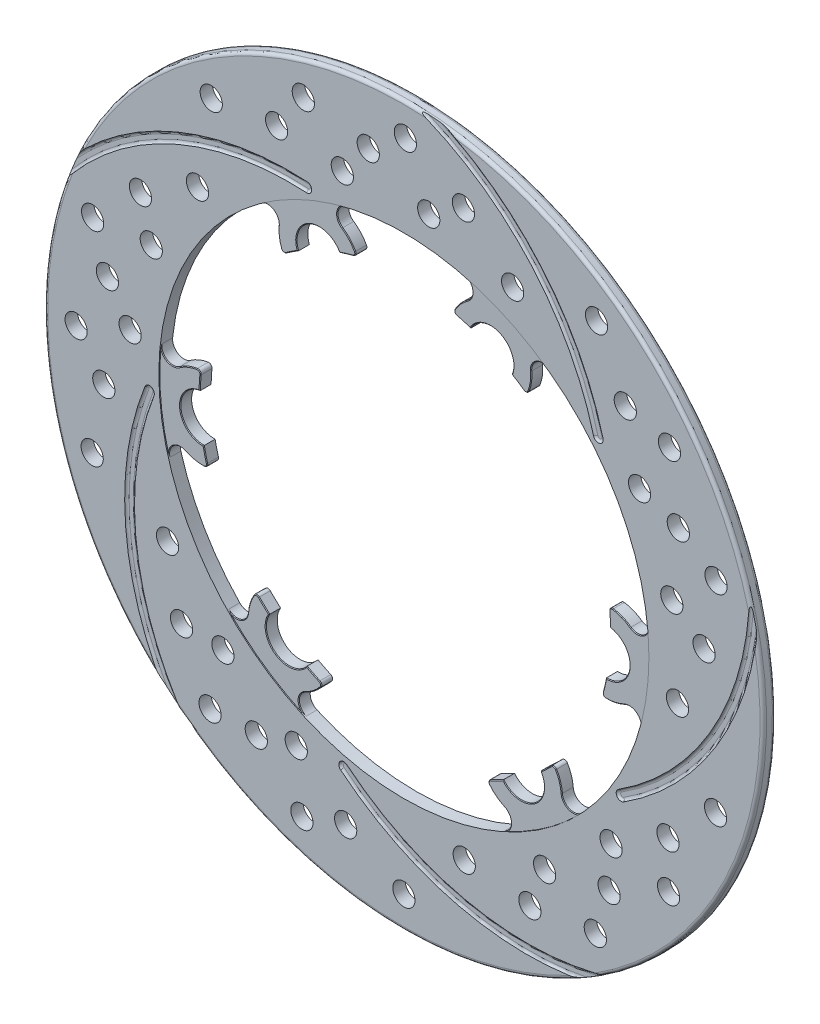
SolidWorks part; units mm, degrees
ref_plane "正面" through (0, 0, 0) normal (0, 0, 1) x (1, 0, 0)
ref_plane "平面" through (0, 0, 0) normal (0, 1, 0) x (1, 0, 0)
ref_plane "右側面" through (0, 0, 0) normal (1, 0, 0) x (0, 0, -1)
sketch "ｽｹｯﾁ1" plane through (0, 0, 0) normal (0, 0, 1) x (1, 0, 0)
  circle A0 centre (0, 0) radius 110
  dimension "D1" = 220
extrude "ﾎﾞｽ - 押し出し1" add sketch "ｽｹｯﾁ1" along normal blind 3.8
sketch "ｽｹｯﾁ2" plane through (0, 0, 0) normal (0, 0, -1) x (-1, 0, 0)
  circle A0 centre (0, 0) radius 75
  dimension "D1" = 150
extrude "ｶｯﾄ - 押し出し1" cut sketch "ｽｹｯﾁ2" against normal blind 4
sketch "ｽｹｯﾁ3" plane through (0, 0, 0) normal (0, 0, -1) x (-1, 0, 0)
  line L0 (0, 0) -> (0, 75) construction
  line L1 (0, 0) -> (26.2023, 56.1911) construction
  arc A7 (18.0218, 72.8026) -> (44.1858, 60.6021) centre (0, 0) cw
  circle A8 centre (0, 0) radius 75 construction
  arc A9 (20.0423, 59.5159) -> (32.7089, 53.6094) centre (26.2023, 56.1911) cw
  arc A10 (15.2472, 62.2106) -> (19.1542, 66.5146) centre (26.2023, 56.1911) cw
  arc A11 (36.3444, 51.2145) -> (32.7089, 53.6094) centre (0, 0) ccw
  arc A12 (20.0423, 59.5159) -> (15.8709, 60.7615) centre (0, 0) ccw
  arc A13 (19.1542, 66.5146) -> (18.0218, 72.8026) centre (17.1807, 69.4051) ccw
  arc A14 (38.641, 57.4277) -> (44.1858, 60.6021) centre (42.1238, 57.774) cw
  arc A15 (38.641, 57.4277) -> (37.8554, 51.6682) centre (26.2023, 56.1911) cw
  arc A24 (37.8554, 51.6682) -> (36.3444, 51.2145) centre (36.9231, 52.03) cw
  arc A25 (15.2472, 62.2106) -> (15.8709, 60.7615) centre (16.1236, 61.729) ccw
  arc A26 (-15.2472, 62.2106) -> (-15.8709, 60.7615) centre (-16.1236, 61.729) cw
  arc A27 (-37.8554, 51.6682) -> (-36.3444, 51.2145) centre (-36.9231, 52.03) ccw
  arc A28 (-38.641, 57.4277) -> (-37.8554, 51.6682) centre (-26.2023, 56.1911) ccw
  arc A29 (-38.641, 57.4277) -> (-44.1858, 60.6021) centre (-42.1238, 57.774) ccw
  arc A30 (-19.1542, 66.5146) -> (-18.0218, 72.8026) centre (-17.1807, 69.4051) cw
  arc A31 (-20.0423, 59.5159) -> (-15.8709, 60.7615) centre (0, 0) cw
  arc A32 (-36.3444, 51.2145) -> (-32.7089, 53.6094) centre (0, 0) cw
  arc A33 (-15.2472, 62.2106) -> (-19.1542, 66.5146) centre (-26.2023, 56.1911) ccw
  arc A34 (-20.0423, 59.5159) -> (-32.7089, 53.6094) centre (-26.2023, 56.1911) ccw
  arc A35 (-18.0218, 72.8026) -> (-44.1858, 60.6021) centre (0, 0) ccw
  dimension "D1" = 62
  dimension "D2" = 14
  dimension "D3" = 5.5
  dimension "D4" = 125.6
  dimension "D5" = 3.5
  dimension "D6" = 1
  dimension "D8" = 25
extrude "ﾎﾞｽ - 押し出し2" add sketch "ｽｹｯﾁ3" against normal offset from surface (3.5 mm away) 0.3
chamfer "面取り1" distance 0.2 angle 45 18 edges at (-40.3849, 60.8114, 3.5) (-38.5876, 54.5016, 3.5) (-37.2107, 51.0723, 3.5) (-34.5474, 52.4435, 3.5) (-29.1607, 62.5352, 3.5) (-17.9674, 60.1749, 3.5) (-15.205, 61.3337, 3.5) (-16.947, 64.5928, 3.5) (-20.6253, 70.0255, 3.5) (20.6253, 70.0255, 3.5) (16.947, 64.5928, 3.5) (15.205, 61.3337, 3.5) (17.9674, 60.1749, 3.5) (29.1607, 62.5352, 3.5) (34.5474, 52.4435, 3.5) (37.2107, 51.0723, 3.5) (38.5876, 54.5016, 3.5) (40.3849, 60.8114, 3.5)
pattern_circular "円形ﾊﾟﾀｰﾝ1" count 3 over 360 about axis through (0, 0, 0) along (0, 0, 1) of "ﾎﾞｽ - 押し出し2", "面取り1"
fillet "ﾌｨﾚｯﾄ1" radius 1 2 edges at (110, 0, 0) (110, 0, 3.8)
sketch "ｽｹｯﾁ4" plane through (0, 0, 3.8) normal (0, 0, 1) x (1, 0, 0)
  line L0 (0, 0) -> (0, -100.3) construction
  line L1 (0, -100.3) -> (0, -110) construction
  line L2 (0, 0) -> (-17.8102, -90.7692) construction
  line L3 (-17.8102, -90.7692) -> (-21.1797, -107.9417) construction
  line L4 (0, 0) -> (-32.937, -77.3819) construction
  line L5 (-32.937, -77.3819) -> (-43.0806, -101.213) construction
  line L6 (-55.3805, -63.2915) -> (-72.4359, -82.7831) construction
  line L7 (-72.3253, -42.9169) -> (-94.5991, -56.1339) construction
  circle A0 centre (0, -100.3) radius 3.4
  circle A1 centre (-17.8102, -90.7692) radius 3.4
  circle A2 centre (-32.937, -77.3819) radius 3.4
  circle A4 centre (0, 0) radius 110 construction
  circle A5 centre (0, 0) radius 110 construction
  circle A6 centre (-31.2099, -95.3207) radius 3.4
  circle A7 centre (-45.1703, -80.7211) radius 3.4
  circle A8 centre (-55.3805, -63.2915) radius 3.4
  circle A9 centre (-59.3211, -80.8771) radius 3.4
  circle A10 centre (-68.0455, -62.6583) radius 3.4
  circle A11 centre (-72.3253, -42.9169) radius 3.4
  point P14 (-44.899, -82.075)
  point P20 (0, 0)
  point P31 (0, 0)
  dimension "D1" = 6.8
  dimension "D2" = 6.8
  dimension "D3" = 6.8
  dimension "D6" = 9.7
  dimension "D4" = 20.2
  dimension "D5" = 20.2
  dimension "D7" = 17.5
  dimension "D8" = 25.9
  dimension "D10" = 26.5
  dimension "D9" = 3
extrude "ｶｯﾄ - 押し出し2" cut sketch "ｽｹｯﾁ4" against normal through all
pattern_circular "円形ﾊﾟﾀｰﾝ2" count 5 over 360 about axis through (0, 0, 0) along (0, 0, 1) of "ｶｯﾄ - 押し出し2"
sketch "ｽｹｯﾁ5" plane through (0, 0, 3.8) normal (0, 0, 1) x (1, 0, 0)
  line L0 (0, 0) -> (-18.414, -75.8849) construction
  line L1 (-18.414, -74.3849) -> (-12.2875, -74.3849) construction
  line L2 (-17.686, -72.8849) -> (-10.8443, -72.8849) construction
  line L3 (-17.8102, -90.7692) -> (37.7552, -7.4394) construction
  line L4 (-15.9239, -87.9404) -> (-12.7572, -90.052) construction
  line L5 (-11.3319, -82.9252) -> (3.4503, -92.7821) construction
  line L6 (0, -100.3) -> (37.7552, -7.4394) construction
  line L7 (1.2806, -97.1504) -> (7.4828, -99.6721) construction
  line L8 (3.8417, -90.8511) -> (24.7693, -99.3599) construction
  line L9 (-32.937, -77.3819) -> (-18.414, -75.8849) construction
  line L10 (-29.555, -77.0333) -> (-29.2913, -79.591) construction
  line L11 (-19.9061, -76.0387) -> (-19.6056, -78.9542) construction
  line L12 (37.7552, -7.4394) -> (38.6742, -94.477) construction
  line L13 (38.6003, -87.4774) -> (41.0575, -87.4514) construction
  line L14 (38.6742, -94.477) -> (41.2524, -94.4498) construction
  arc A0 (-18.414, -75.8849) -> (66.5668, -91.1631) centre (37.7552, -7.4394) ccw construction
  arc A1 (-17.4624, -74.7253) -> (61.5542, -91.1651) centre (37.7552, -7.4394) ccw
  arc A2 (-19.3656, -77.0444) -> (53.5491, -96.0859) centre (37.7552, -7.4394) ccw
  arc A3 (-19.3656, -77.0444) -> (-17.4624, -74.7253) centre (-18.414, -75.8849) cw
  circle A4 centre (0, 0) radius 75 construction
  circle A5 centre (-17.8102, -90.7692) radius 3.4 construction
  circle A6 centre (0, -100.3) radius 3.4 construction
  circle A7 centre (-32.937, -77.3819) radius 3.4 construction
  circle A8 centre (38.5644, -84.0776) radius 3.4 construction
  arc A9 (53.5491, -96.0859) -> (61.5542, -91.1651) centre (0, 0) ccw
  circle A10 centre (0, 0) radius 110 construction
  point P7 (61.5572, -91.1631)
  point P47 (0, 0)
  dimension "D1" = 3
  dimension "D2" = 1.5
  dimension "D3" = 6.8
  dimension "D4" = 6.8
  dimension "D5" = 9.7
  dimension "D6" = 7
extrude "ｶｯﾄ - 押し出し3" cut sketch "ｽｹｯﾁ5" against normal blind 0.5
fillet "ﾌｨﾚｯﾄ2" radius 1 3 edges at (14.8055, -94.5081, 3.3) (-19.5735, -74.9333, 3.3) (19.8153, -92.613, 3.3)
pattern_circular "円形ﾊﾟﾀｰﾝ3" count 5 over 360 about axis through (0, 0, 0) along (0, 0, 1) of "ﾌｨﾚｯﾄ2", "ｶｯﾄ - 押し出し3"
ref_plane "平面1" through (0, 0, 1.9) normal (0, 0, 1) x (1, 0, 0)
mirror "ﾐﾗｰ1" about plane through (0, 0, 1.9) normal (0, 0, 1) of "円形ﾊﾟﾀｰﾝ3", "ﾌｨﾚｯﾄ2", "ｶｯﾄ - 押し出し3"
